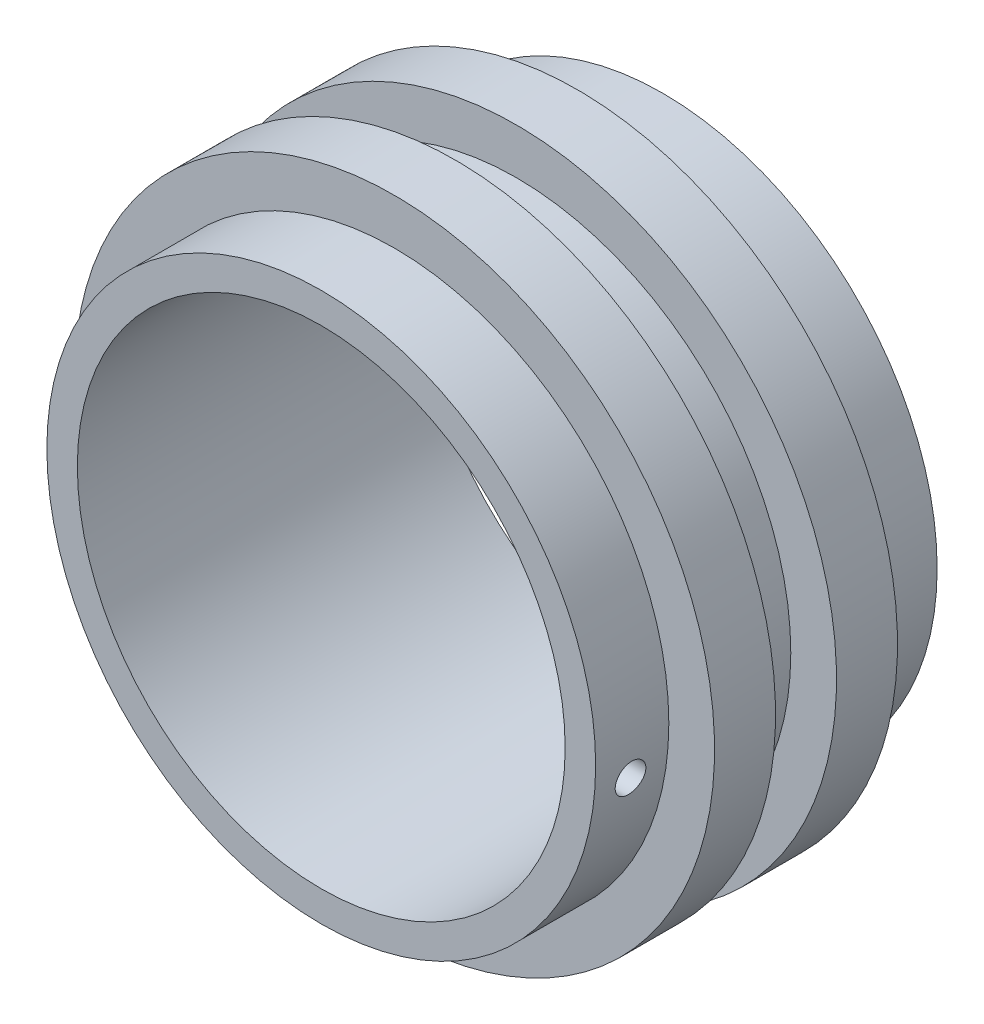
SolidWorks part; units mm, degrees
ref_plane "Front Plane" through (0, 0, 0) normal (0, 0, 1) x (1, 0, 0)
ref_plane "Top Plane" through (0, 0, 0) normal (0, 1, 0) x (1, 0, 0)
ref_plane "Right Plane" through (0, 0, 0) normal (1, 0, 0) x (0, 0, -1)
sketch "Sketch2" plane through (0, 0, 0) normal (0, 0, 1) x (1, 0, 0)
  circle A0 centre (0, 0) radius 57.15
  dimension "D1" = 114.3
extrude "Boss-Extrude1" add sketch "Sketch2" along normal blind 152.4
sketch "Sketch3" plane through (0, 0, 152.4) normal (0, 0, 1) x (1, 0, 0)
  circle A0 centre (0, 0) radius 50.8
  dimension "D1" = 101.6
extrude "Cut-Extrude1" cut sketch "Sketch3" against normal blind 152.4
sketch "Sketch34" plane through (0, 0, 152.4) normal (0, 0, 1) x (1, 0, 0)
  line L0 (-76.2, -50.8) -> (76.2, -50.8)
  line L1 (-76.2, -50.8) -> (-76.2, -76.2)
  line L2 (76.2, -50.8) -> (76.2, -76.2)
  line L3 (-76.2, -76.2) -> (76.2, -76.2)
  circle A0 centre (0, 0) radius 50.8 construction
  point P6 (-76.2, -63.5)
  dimension "D1" = 50.8
  dimension "D2" = 152.4
  dimension "D3" = 76.2
  dimension "D4" = 25.4
extrude "Boss-Extrude3" add sketch "Sketch34" against normal blind 25.4
sketch "Sketch35" plane through (0, 0, 152.4) normal (0, 0, 1) x (1, 0, 0)
  line L0 (-76.2, -50.8) -> (-76.2, -76.2) construction
  circle A0 centre (-63.5, -63.5) radius 8.255
  circle A1 centre (63.5, -63.5) radius 8.255
  dimension "D1" = 16.51
  dimension "D2" = 16.51
  dimension "D3" = 127
  dimension "D4" = 12.7
extrude "Cut-Extrude2" cut sketch "Sketch35" against normal blind 30.48
sketch "Sketch37" plane through (0, 0, 0) normal (0, 0, -1) x (-1, 0, 0)
  circle A0 centre (0, 0) radius 66.675
  circle A1 centre (0, 0) radius 57.15
  dimension "D1" = 133.35
extrude "Boss-Extrude4" add sketch "Sketch37" against normal blind 12.7 from offset 99.06
sketch "Sketch38" plane through (0, 0, 0) normal (0, 0, -1) x (-1, 0, 0)
  circle A0 centre (0, 0) radius 66.675
  circle A1 centre (0, 0) radius 57.15
extrude "Boss-Extrude5" add sketch "Sketch38" along normal blind 12.7 from offset 83.82
sketch "Sketch39" plane through (0, 0, 0) normal (0, 0, -1) x (-1, 0, 0)
  circle A0 centre (0, 0) radius 66.675
  circle A1 centre (0, 0) radius 57.15
extrude "Boss-Extrude6" add sketch "Sketch39" along normal blind 12.7 from offset 55.88
sketch "Sketch40" plane through (0, 0, 0) normal (0, 0, -1) x (-1, 0, 0)
  circle A0 centre (0, 0) radius 66.675
  circle A1 centre (0, 0) radius 57.15
extrude "Boss-Extrude7" add sketch "Sketch40" along normal blind 12.7 from offset 30.48
sketch "Sketch41" plane through (76.2, 0, 0) normal (1, 0, 0) x (0, 0, -1)
  line L0 (-152.4, -76.2) -> (-71.12, -76.2)
  line L1 (-152.4, -76.2) -> (-152.4, 71.1226)
  line L2 (-71.12, -76.2) -> (-71.12, 71.1226)
  line L3 (-152.4, 71.1226) -> (-71.12, 71.1226)
  dimension "D1" = 81.28
sketch "Sketch42" plane through (76.2, 0, 0) normal (1, 0, 0) x (0, 0, -1)
  circle A0 centre (-63.5188, -6.2316) radius 3.175
  circle A1 centre (-36.8488, -6.2316) radius 3.175
  dimension "D1" = 26.67
  dimension "D2" = 6.35
  dimension "D3" = 6.35
extrude "Cut-Extrude4" cut sketch "Sketch42" against normal blind 101.6 contours A1 | A0
extrude "Cut-Extrude5" cut sketch "Sketch41" against normal blind 199.136
